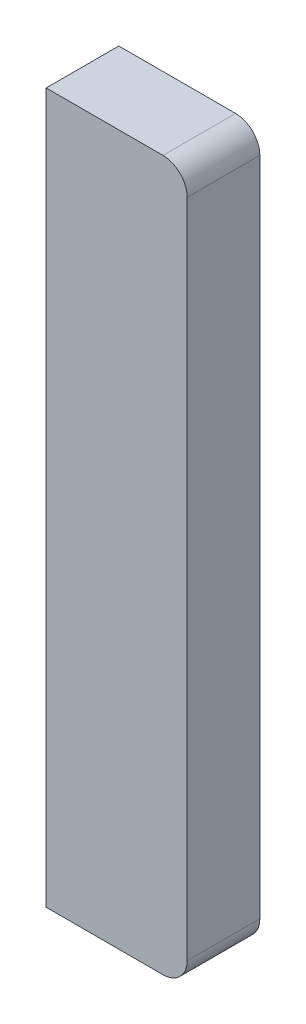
SolidWorks part; units mm, degrees
ref_plane "Plan de face" through (0, 0, 0) normal (0, 0, 1) x (1, 0, 0)
ref_plane "Plan de dessus" through (0, 0, 0) normal (0, 1, 0) x (1, 0, 0)
ref_plane "Plan de droite" through (0, 0, 0) normal (1, 0, 0) x (0, 0, -1)
sketch "Esquisse1" plane through (0, 0, 0) normal (0, 0, 1) x (1, 0, 0)
  line L0 (10, -28.0143) -> (10, -1) construction
  line L1 (14.8224, -42.6651) -> (-4, -42.6651) construction
  line L2 (15.8224, -13.3635) -> (15.8224, -41.6651) construction
  line L3 (10, -42.6651) -> (10, -13.3635)
  line L4 (14.8224, -42.6651) -> (10, -42.6651)
  line L5 (15.8224, -14.3635) -> (15.8224, -41.6651)
  line L6 (14.8224, -13.3635) -> (10, -13.3635)
  arc A0 (14.8224, -42.6651) -> (15.8224, -41.6651) centre (14.8224, -41.6651) ccw construction
  arc A1 (14.8224, -42.6651) -> (15.8224, -41.6651) centre (14.8224, -41.6651) ccw
  arc A2 (15.8224, -14.3635) -> (14.8224, -13.3635) centre (14.8224, -14.3635) ccw
  dimension "D1" = 1
extrude "Boss.-Extru.1" add sketch "Esquisse1" along normal up to surface (3 mm away)
